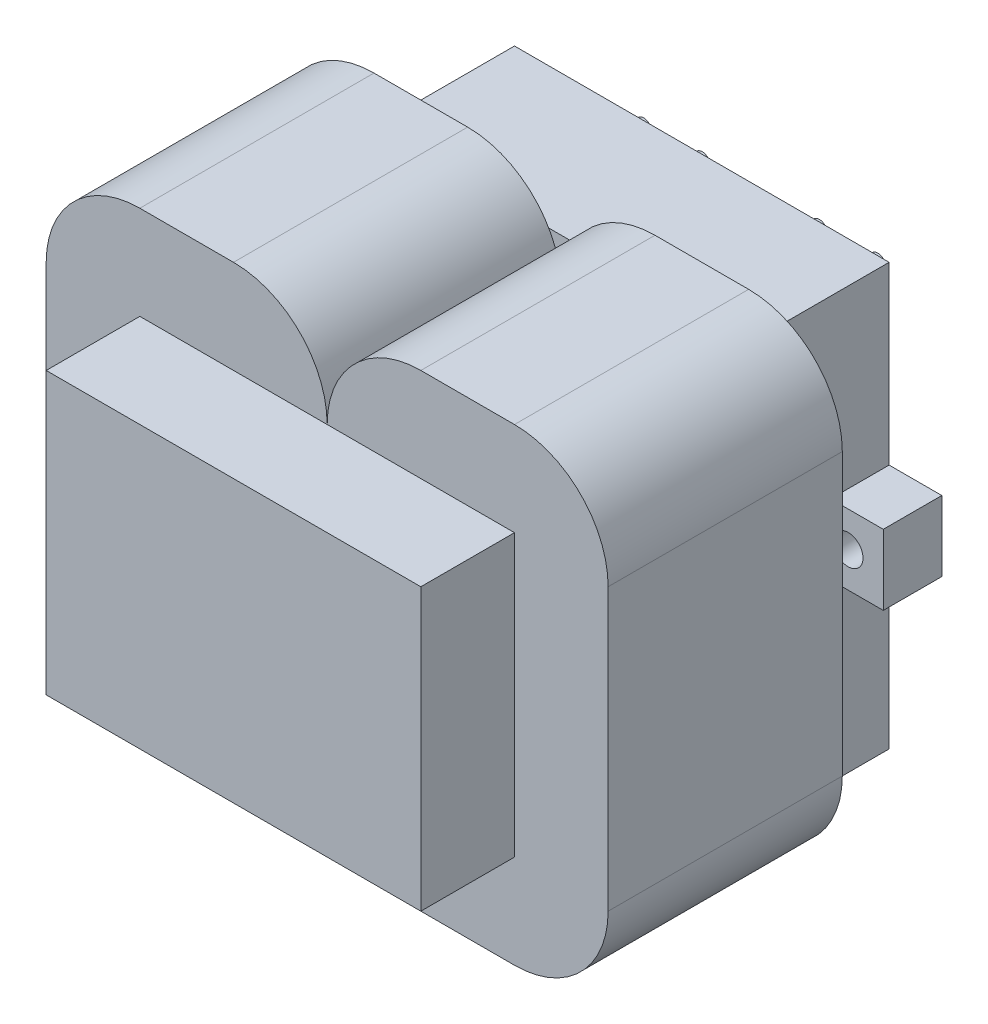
SolidWorks part; units mm, degrees
ref_plane "Front Plane" through (0, 0, 0) normal (0, 0, 1) x (1, 0, 0)
ref_plane "Top Plane" through (0, 0, 0) normal (0, 1, 0) x (1, 0, 0)
ref_plane "Right Plane" through (0, 0, 0) normal (1, 0, 0) x (0, 0, -1)
sketch "Sketch1" plane through (0, 0, 0) normal (0, 0, 1) x (1, 0, 0)
  line L1 (-16, 16) -> (16, 16)
  line L2 (-16, 16) -> (-16, -20)
  line L3 (-16, -20) -> (16, -20)
  line L4 (16, 16) -> (16, -20)
extrude "Boss-Extrude1" add sketch "Sketch1" along normal blind 12
sketch "Sketch2" plane through (16, 0, 0) normal (1, 0, 0) x (0, 0, -1)
  line L0 (0, -20) -> (0, 16) construction
  line L1 (0, 1) -> (-5, 1)
  line L2 (0, 1) -> (0, -5)
  line L3 (0, -5) -> (-5, -5)
  line L4 (-5, 1) -> (-5, -5)
extrude "Boss-Extrude2" add sketch "Sketch2" along normal blind 4.5
sketch "Sketch3" plane through (-16, 0, 0) normal (-1, 0, 0) x (0, 0, 1)
  line L0 (0, 16) -> (0, -20) construction
  line L1 (0, 1) -> (5, 1)
  line L2 (0, 1) -> (0, -5)
  line L3 (0, -5) -> (5, -5)
  line L4 (5, 1) -> (5, -5)
extrude "Boss-Extrude3" add sketch "Sketch3" along normal blind 4.5
sketch "Sketch4" plane through (0, 0, 0) normal (0, 0, -1) x (-1, 0, 0)
  circle A0 centre (-17.5006, -1.999) radius 1.27
  circle A1 centre (17.5006, -1.999) radius 1.27
extrude "Cut-Extrude1" cut sketch "Sketch4" against normal up to surface (5 mm away)
sketch "Sketch5" plane through (0, 0, 0) normal (0, 0, -1) x (-1, 0, 0)
  circle A0 centre (-10, -12.9997) radius 0.6604
  circle A5 centre (10, -12.9997) radius 0.6604
  circle A6 centre (-12.4993, 12.9997) radius 0.6604
  circle A7 centre (-7.5006, 12.9997) radius 0.6604
  circle A9 centre (2.4994, 12.9997) radius 0.6604
  circle A10 centre (7.5006, 12.9997) radius 0.6604
extrude "Boss-Extrude4" add sketch "Sketch5" along normal blind 2.54 separate body
sketch "Sketch6" plane through (0, 0, 12) normal (0, 0, 1) x (1, 0, 0)
  line L1 (-16, 12) -> (16, 12)
  line L2 (-16, 12) -> (-16, -12)
  line L3 (-16, -12) -> (16, -12)
  line L4 (16, 12) -> (16, -12)
extrude "Boss-Extrude5" add sketch "Sketch6" along normal blind 28
sketch "Sketch7" plane through (0, 0, 12) normal (0, 0, 1) x (1, 0, 0)
  line L0 (-16, -20) -> (-8, -20)
  line L2 (-16, -20) -> (16, -20) construction
  line L3 (8, -20) -> (16, -20)
  line L5 (-8, 20) -> (-16, 20)
  line L6 (8, 20) -> (16, 20)
  line L7 (-24, -12) -> (-24, 12)
  line L8 (24, 12) -> (24, -12)
  line L10 (-16, -12) -> (-16, -20) construction
  line L11 (16, 12) -> (-16, 12) construction
  line L12 (16, 12) -> (-16, 12) construction
  line L13 (-16, -12) -> (16, -12) construction
  line L14 (-16, -12) -> (16, -12) construction
  arc A0 (-24, -12) -> (-16, -20) centre (-16, -12) ccw
  arc A1 (16, -20) -> (24, -12) centre (16, -12) ccw
  arc A2 (-24, 12) -> (-16, 20) centre (-16, 12) cw
  arc A3 (24, 12) -> (16, 20) centre (16, 12) ccw
  arc A4 (-8, 20) -> (0, 12) centre (-8, 12) cw
  arc A5 (0, 12) -> (8, 20) centre (8, 12) cw
  arc A6 (-8, -20) -> (0, -12) centre (-8, -12) ccw
  arc A7 (0, -12) -> (8, -20) centre (8, -12) ccw
extrude "Boss-Extrude6" add sketch "Sketch7" along normal blind 20 separate body
